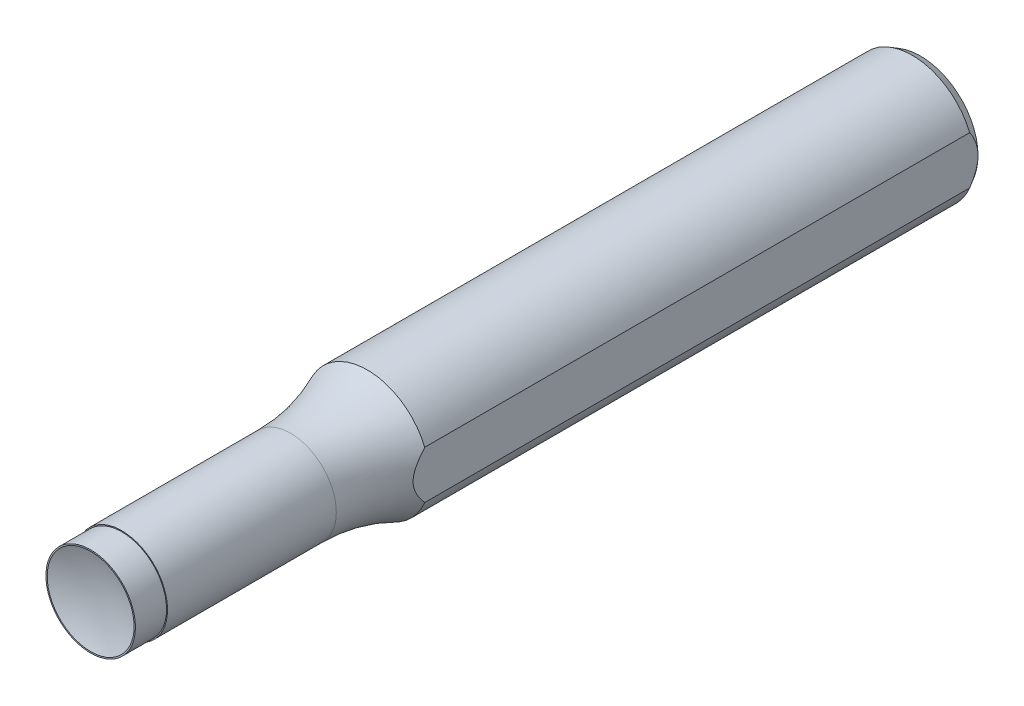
SolidWorks part; units mm, degrees
ref_plane "Front Plane" through (0, 0, 0) normal (0, 0, 1) x (1, 0, 0)
ref_plane "Top Plane" through (0, 0, 0) normal (0, 1, 0) x (1, 0, 0)
ref_plane "Right Plane" through (0, 0, 0) normal (1, 0, 0) x (0, 0, -1)
sketch "Sketch1" plane through (0, 0, 0) normal (0, 0, 1) x (1, 0, 0)
  circle A0 centre (0, 0) radius 9.525
  dimension "D1" = 19.05
extrude "Boss-Extrude1" add sketch "Sketch1" against normal blind 127
sketch "Sketch2" plane through (0, 0, 0) normal (0, 0, 1) x (1, 0, 0)
  circle A0 centre (0, 0) radius 7
  dimension "D1" = 14
extrude "Cut-Extrude1" cut sketch "Sketch2" against normal blind 42.3333 flip side to cut
sketch "Sketch3" plane through (0, 0, 0) normal (0, 0, 1) x (1, 0, 0)
  circle A0 centre (0, 0) radius 6.85
  dimension "D1" = 13.7
extrude "Cut-Extrude2" cut sketch "Sketch3" against normal blind 4.7625 flip side to cut
sketch "Sketch4" plane through (0, 0, 0) normal (1, 0, 0) x (0, 0, -1)
  line L0 (0, 0) -> (0, 6.65)
  line L1 (0, 6.85) -> (0, -6.85) construction
  line L2 (1.1984, 0) -> (1.1984, 6.65) construction
  line L3 (0, 0) -> (1.1984, 0)
  line L4 (0, 0) -> (0, -6.65) construction
  arc A0 (1.1984, 0) -> (0, 6.65) centre (-17.8516, 0) ccw
  dimension "D2" = 19.05
  dimension "D1" = 13.3
revolve "Cut-Revolve1" cut sketch "Sketch4" angle 360 about L3
chamfer "Chamfer1" distance 1.27 angle 30 1 edges at (9.525, 0, -127)
sketch "Sketch5" plane through (0, 0, 0) normal (1, 0, 0) x (0, 0, -1)
  line L0 (42.3333, 0) -> (30.5891, 0)
  line L1 (42.3333, 9.525) -> (42.3333, -9.525) construction
  line L2 (30.5891, 0) -> (30.5891, 7)
  line L3 (42.3333, 7) -> (4.7625, 7) construction
  line L4 (42.3333, 9.525) -> (42.3333, 0)
  line L5 (30.5891, 7) -> (42.3333, 7) construction
  arc A0 (30.5891, 7) -> (42.3333, 9.525) centre (30.5891, 35.575) ccw
  dimension "D1" = 28.575
revolve "Revolve1" add sketch "Sketch5" angle 360 about L0
sketch "Sketch6" plane through (0, 0, 0) normal (1, 0, 0) x (0, 0, -1)
  line L0 (84.6667, 0) -> (108.4867, 0)
  line L1 (84.6667, 0) -> (84.6667, 19.05)
  line L2 (84.6667, 19.05) -> (91.9889, 19.05)
  line L3 (108.4867, 0) -> (108.4867, 9.525)
  line L4 (125.73, 9.525) -> (42.3333, 9.525) construction
  line L5 (108.4867, 9.525) -> (84.6667, 9.525) construction
  line L6 (127, -9.525) -> (127, 9.525) construction
  arc A0 (108.4867, 9.525) -> (91.9889, 19.05) centre (108.4867, 28.575) cw
  dimension "D2" = 19.05
  dimension "D1" = 42.3333
  dimension "D3" = 23.82
revolve "Revolve2" [suppressed] add sketch "Sketch6" angle 360 about L0
sketch "Sketch7" plane through (0, 0, -127) normal (0, 0, -1) x (-1, 0, 0)
  line L9 (-16.1213, 3.6648) -> (-8.7918, 3.6648)
  line L10 (-16.1213, 3.6648) -> (-16.1213, -3.6648)
  line L11 (-16.1213, -3.6648) -> (-8.7918, -3.6648)
  line L12 (-8.7918, 3.6648) -> (-8.7918, -3.6648)
  circle A5 centre (0, 0) radius 9.525 construction
  circle A6 centre (0, 0) radius 8.7918 construction
  point P8 (-8.7918, 0)
extrude "Cut-Extrude3" cut sketch "Sketch7" against normal through all
